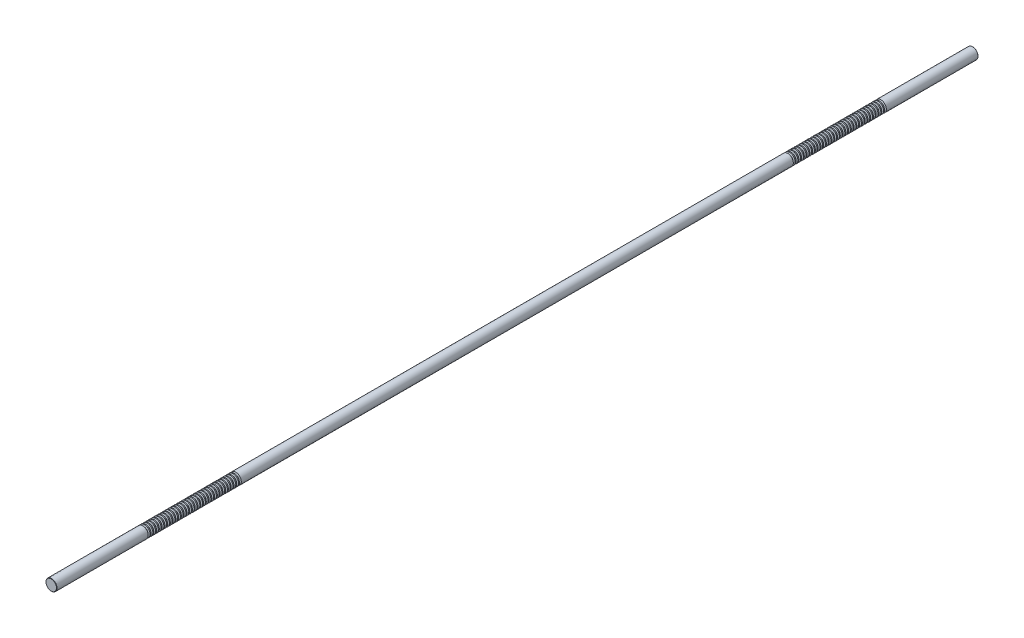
SolidWorks part; units mm, degrees
ref_plane "Front Plane" through (0, 0, 0) normal (0, 0, 1) x (1, 0, 0)
ref_plane "Top Plane" through (0, 0, 0) normal (0, 1, 0) x (1, 0, 0)
ref_plane "Right Plane" through (0, 0, 0) normal (1, 0, 0) x (0, 0, -1)
sketch "Sketch1" plane through (0, 0, 0) normal (0, 0, 1) x (1, 0, 0)
  circle A0 centre (0, 0) radius 6
  dimension "D1" = 12
extrude "Boss-Extrude1" add sketch "Sketch1" along normal mid plane 1000
chamfer "Chamfer1" distance 0.3 angle 45 2 edges at (6, 0, -500) (6, 0, 500)
sketch "Sketch2" plane through (0, 0, 0) normal (1, 0, 0) x (0, 0, -1)
  line L0 (400.2345, 6) -> (398.2655, 6)
  line L1 (499.7, 6) -> (-499.7, 6) construction
  line L2 (398.2655, 6) -> (398.7345, 4.25)
  line L3 (398.7345, 4.25) -> (399.7655, 4.25)
  line L4 (399.7655, 4.25) -> (400.2345, 6)
  line L5 (500, -5.7) -> (500, 5.7) construction
  point P4 (399.25, 6)
  point P7 (399.25, 4.25)
  point P8 (400, 5.125)
  point P9 (398.5, 5.125)
  dimension "D1" = 1.5
  dimension "D2" = 100
  dimension "D3" = 1.75
  dimension "D4" = 30
revolve "Cut-Revolve1" cut sketch "Sketch2" angle 360 about axis through (0, 0, 500) along (0, 0, -1)
pattern_linear "LPattern1" count 34 spacing 3 along (0, 0, 1) of "Cut-Revolve1"
pattern_linear "LPattern2" count 2 spacing 700 along (0, 0, 1) of "Cut-Revolve1", "LPattern1"
